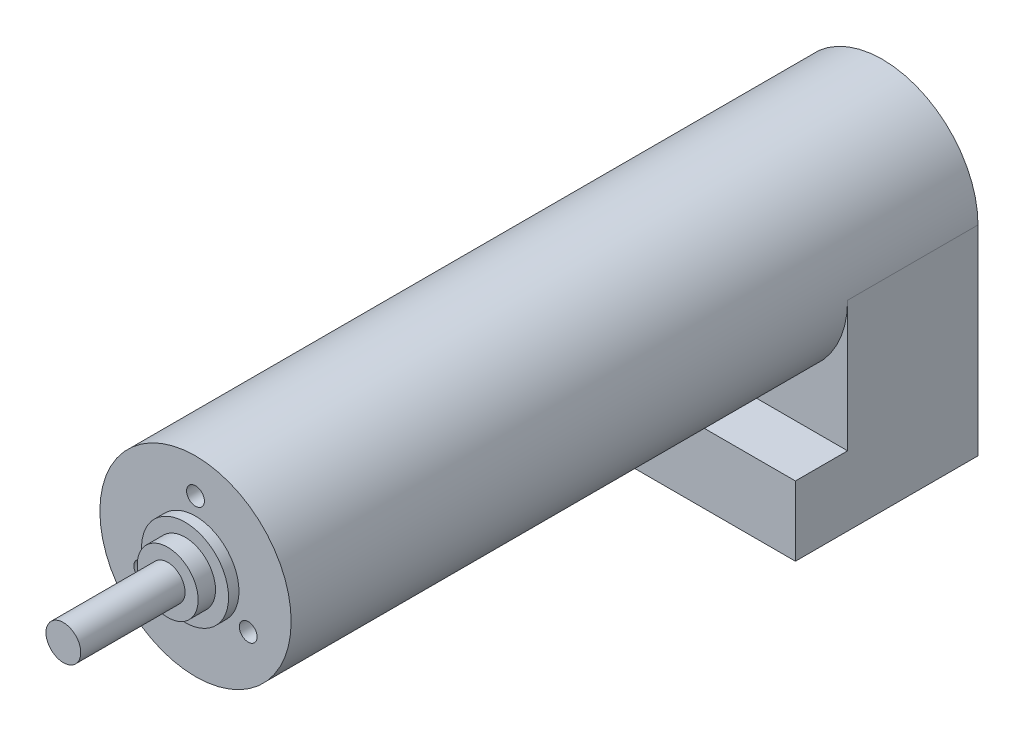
SolidWorks part; units mm, degrees
ref_plane "前视基准面" through (0, 0, 0) normal (0, 0, 1) x (1, 0, 0)
ref_plane "上视基准面" through (0, 0, 0) normal (0, 1, 0) x (1, 0, 0)
ref_plane "右视基准面" through (0, 0, 0) normal (1, 0, 0) x (0, 0, -1)
sketch "草图2" plane through (0, 0, 0) normal (0, 0, 1) x (1, 0, 0)
  circle A0 centre (0, 0) radius 11
  dimension "D1" = 22
extrude "凸台-拉伸1" add sketch "草图2" along normal blind 64
sketch "草图3" plane through (0, 0, 0) normal (0, 0, -1) x (-1, 0, 0)
  line L0 (-11, 0) -> (-11, -23)
  line L1 (-11, -23) -> (11, -23)
  line L2 (11, -23) -> (11, 0)
  circle A0 centre (0, 0) radius 11 construction
  arc A1 (11, 0) -> (-11, 0) centre (0, 0) ccw
  dimension "D1" = 23
extrude "凸台-拉伸2" add sketch "草图3" along normal blind 15
sketch "草图4" plane through (0, 0, -15) normal (0, 0, -1) x (-1, 0, 0)
  line L0 (11, -23) -> (11, 0) construction
  line L1 (-11, -23) -> (11, -23)
  line L2 (-11, -23) -> (-11, -15)
  line L3 (-11, -15) -> (11, -15)
  line L4 (11, -23) -> (11, -15)
  dimension "D1" = 8
extrude "凸台-拉伸3" add sketch "草图4" against normal blind 21
hole_wizard "M2.5 螺纹孔1" positions "草图5" profile "草图6" tap size "M2.5" standard "GB"
sketch "草图5" plane through (0, 0, 64) normal (0, 0, 1) x (1, 0, 0)
  line L1 (0, 0) -> (0, 7) construction
  circle A0 centre (0, 0) radius 7
  point P10 (0, 7)
  point P19 (6.0622, -3.5)
  point P20 (-6.0622, -3.5)
  dimension "D1" = 14
  dimension "D2" = 3
sketch "草图6" plane through (-6.0622, -3.5, 64) normal (1, 0, 0) x (0, -1, 0)
  line L0 (0, 0) -> (0, 79)
  line L1 (0, 79) -> (1.025, 79)
  line L2 (1.025, 79) -> (1.025, 0)
  line L5 (1.025, 0) -> (0, 0)
  line L11 (0, -6.35) -> (0, 107.95) construction
  dimension "通孔螺纹孔钻头直径" = 2.05
  dimension "通孔螺纹孔钻头深度" = 79
sketch "草图7" plane through (0, 0, 64) normal (0, 0, 1) x (1, 0, 0)
  circle A0 centre (0, 0) radius 5
  dimension "D1" = 10
extrude "凸台-拉伸4" add sketch "草图7" along normal blind 1.2
sketch "草图8" plane through (0, 0, 65.2) normal (0, 0, 1) x (1, 0, 0)
  circle A0 centre (0, 0) radius 3.5
  dimension "D1" = 7
extrude "凸台-拉伸5" add sketch "草图8" along normal blind 2
sketch "草图9" plane through (0, 0, 67.2) normal (0, 0, 1) x (1, 0, 0)
  circle A0 centre (0, 0) radius 2
  dimension "D1" = 4
extrude "凸台-拉伸6" add sketch "草图9" along normal blind 12 contours A0
